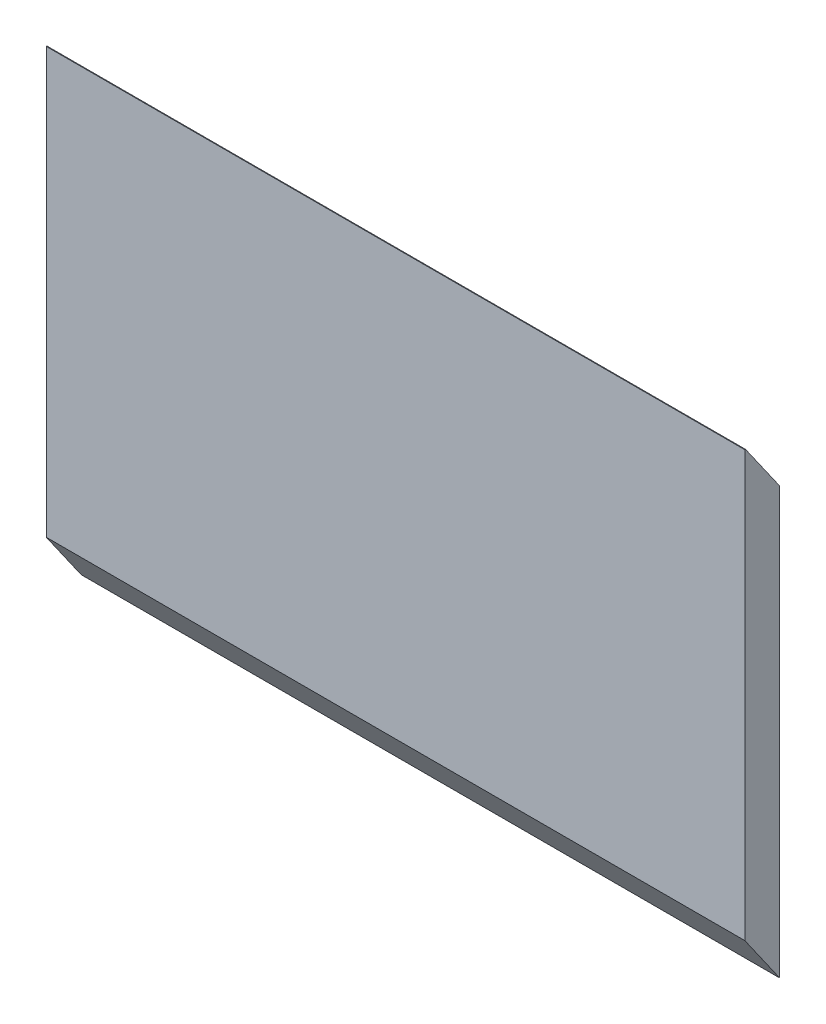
SolidWorks part; units mm, degrees
ref_plane "Front Plane" through (0, 0, 0) normal (0, 0, 1) x (1, 0, 0)
ref_plane "Top Plane" through (0, 0, 0) normal (0, 1, 0) x (1, 0, 0)
ref_plane "Right Plane" through (0, 0, 0) normal (1, 0, 0) x (0, 0, -1)
sketch "Sketch2" plane through (0, 0, 0) normal (0, 0, 1) x (1, 0, 0)
  line L0 (0, 43.18) -> (0, -43.18) construction
  line L1 (-63.5, 43.18) -> (63.5, 43.18)
  line L2 (-63.5, 43.18) -> (-63.5, -43.18)
  line L3 (-63.5, -43.18) -> (63.5, -43.18)
  line L4 (63.5, 43.18) -> (63.5, -43.18)
  dimension "D1" = 127
  dimension "D2" = 86.36
extrude "Boss-Extrude1" add sketch "Sketch2" along normal mid plane 6.35
chamfer "Chamfer1" distance 8.89 angle 35 1 edges at (0, 43.18, -3.175)
chamfer "Chamfer2" distance 6.35 angle 55 1 edges at (0, -43.18, 3.175)
